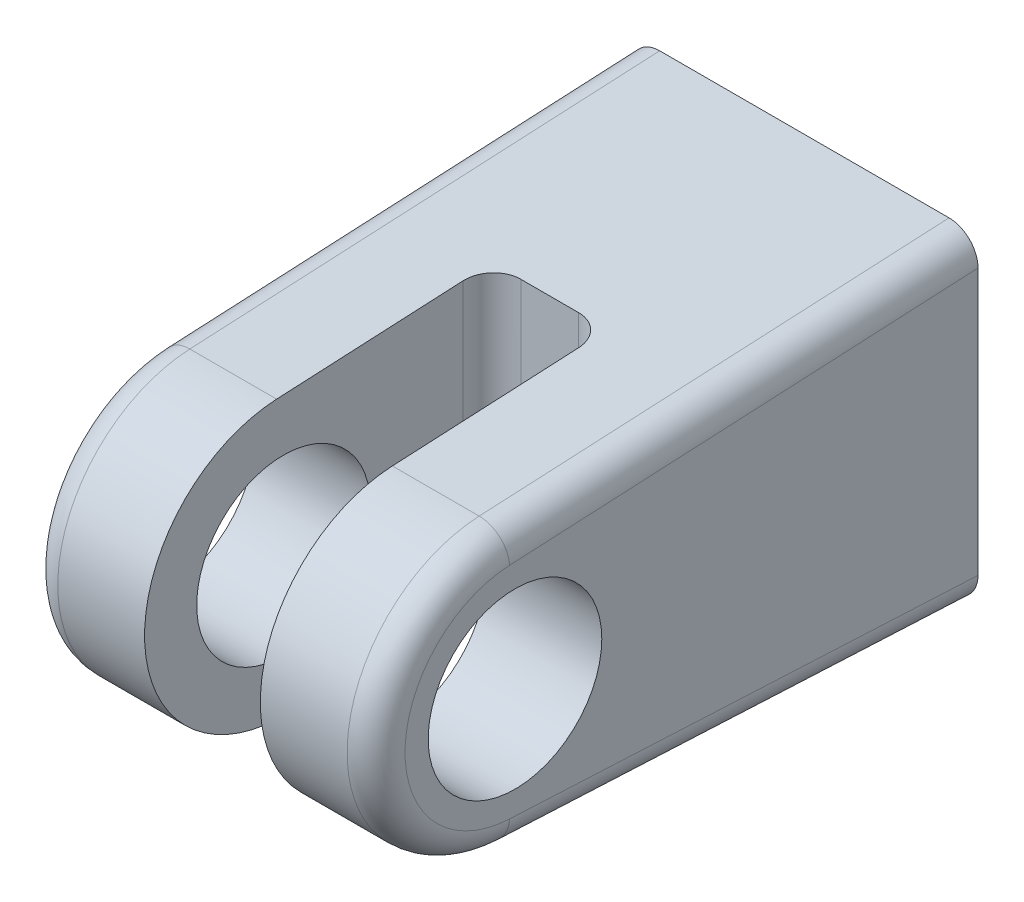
SolidWorks part; units mm, degrees
ref_plane "Front" through (0, 0, 0) normal (0, 0, 1) x (1, 0, 0)
ref_plane "Top" through (0, 0, 0) normal (0, 1, 0) x (1, 0, 0)
ref_plane "Right" through (0, 0, 0) normal (1, 0, 0) x (0, 0, -1)
sketch "Sketch2" plane through (0, 0, 0) normal (1, 0, 0) x (0, 0, -1)
  line L0 (0, 8.89) -> (-25.7777, 7.6106)
  line L1 (0, -8.89) -> (-25.7777, -7.6106)
  line L2 (0, 8.89) -> (0, -8.89)
  line L3 (0, 0) -> (-66.2459, 0) construction
  arc A0 (-25.7777, 7.6106) -> (-25.7777, -7.6106) centre (-25.4, 0) ccw
  dimension "D1" = 7.62
  dimension "D2" = 17.78
  dimension "D3" = 25.4
extrude "Extrude2" add sketch "Sketch2" along normal mid plane 19.05
sketch "Sketch3" plane through (0, 0, 0) normal (0, 1, 0) x (1, 0, 0)
  line L0 (0, -13.97) -> (0, 0) construction
  line L1 (-3.175, -13.97) -> (3.175, -13.97)
  line L2 (-3.175, -13.97) -> (-3.175, -33.02)
  line L3 (-3.175, -33.02) -> (3.175, -33.02)
  line L4 (3.175, -13.97) -> (3.175, -33.02)
  line L5 (-9.525, -33.02) -> (9.525, -33.02) construction
  dimension "D1" = 6.35
  dimension "D2" = 19.05
extrude "Cut-Extrude1" cut sketch "Sketch3" against normal through all and the other way through all
sketch "Sketch4" plane through (9.525, 0, 0) normal (1, 0, 0) x (0, 0, -1)
  circle A0 centre (-25.4, 0) radius 4.7625
  dimension "D1" = 9.525
extrude "Cut-Extrude2" cut sketch "Sketch4" against normal through all
sketch "Sketch5" plane through (0, 0, 0) normal (0, 0, -1) x (-1, 0, 0)
  circle A0 centre (0, 0) radius 6.35
  dimension "D1" = 12.7
extrude "Cut-Extrude3" cut sketch "Sketch5" against normal blind 9.525
fillet "Fillet1" radius 1.5875
